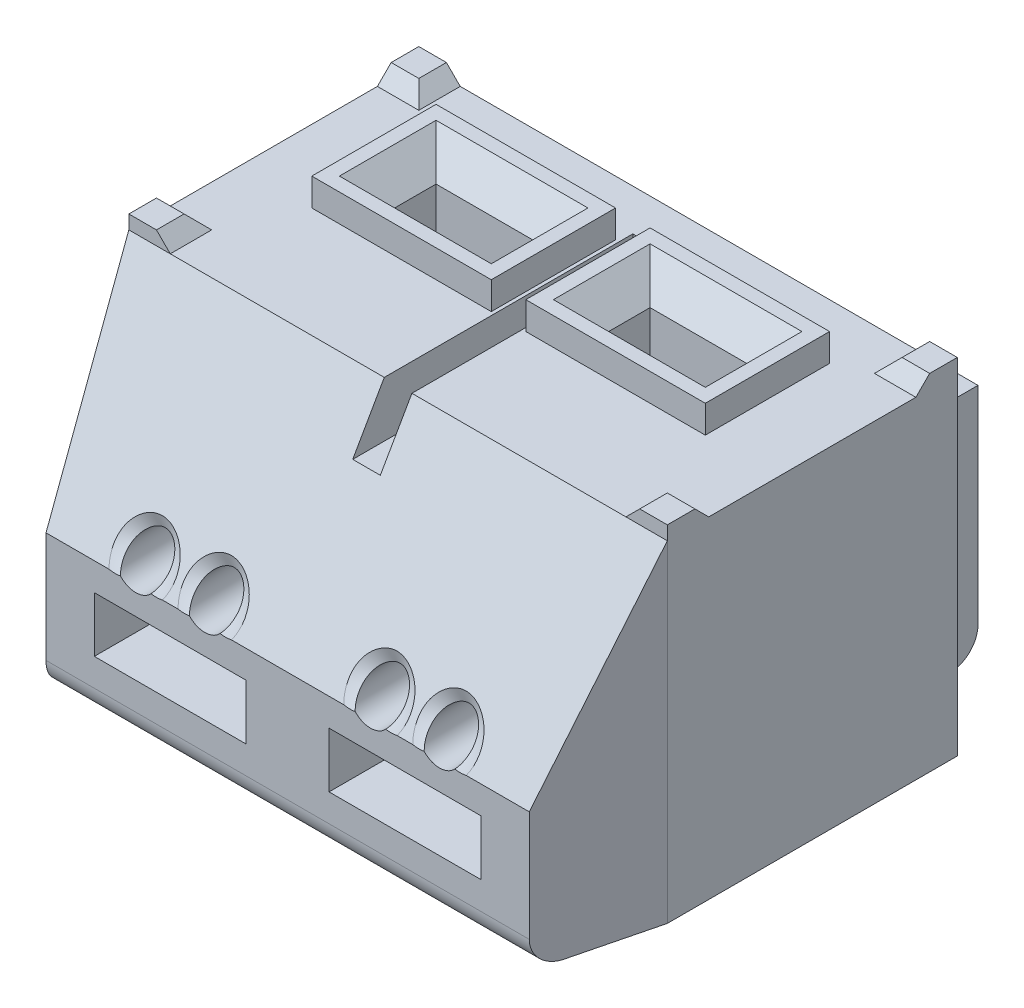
SolidWorks part; units mm, degrees
ref_plane "Plan de face" through (0, 0, 0) normal (0, 0, 1) x (1, 0, 0)
ref_plane "Plan de dessus" through (0, 0, 0) normal (0, 1, 0) x (1, 0, 0)
ref_plane "Plan de droite" through (0, 0, 0) normal (1, 0, 0) x (0, 0, -1)
sketch "Esquisse1" plane through (0, 0, 0) normal (0, 1, 0) x (1, 0, 0)
  line L1 (-9.75, 9) -> (9.75, 9)
  line L2 (-9.75, 9) -> (-9.75, -9)
  line L3 (-9.75, -9) -> (9.75, -9)
  line L4 (9.75, 9) -> (9.75, -9)
  dimension "D1" = 19.5
  dimension "D2" = 9.75
  dimension "D3" = 18
  dimension "D4" = 9
extrude "Extrusion1" add sketch "Esquisse1" along normal blind 12
sketch "Esquisse2" plane through (0, 12, 0) normal (0, 1, 0) x (-1, 0, 0)
  line L0 (0, 7.1336) -> (0, -6.4225) construction
  line L1 (-9.75, -9) -> (9.75, -9) construction
  line L2 (7.125, -3.5) -> (0.625, -3.5)
  line L3 (7.125, -3.5) -> (7.125, 1)
  line L4 (7.125, 1) -> (0.625, 1)
  line L5 (0.625, -3.5) -> (0.625, 1)
  line L6 (-7.125, 1) -> (-0.625, 1)
  line L7 (-0.625, -3.5) -> (-0.625, 1)
  line L8 (-7.125, -3.5) -> (-7.125, 1)
  line L9 (-7.125, -3.5) -> (-0.625, -3.5)
  dimension "D1" = 6.5
  dimension "D2" = 1.25
  dimension "D3" = 5.5
  dimension "D4" = 4.5
extrude "Extrusion2" add sketch "Esquisse2" along normal blind 1
sketch "Esquisse3" plane through (0, 0, -9) normal (0, 0, -1) x (-1, 0, 0)
  line L0 (-7, 8.5) -> (7, 8.5)
  line L1 (7, 8.5) -> (7, -0.9891)
  line L2 (10.3623, -0.9891) -> (10.3623, 14.3031)
  line L3 (10.3623, 14.3031) -> (-10.2681, 14.3031)
  line L4 (-10.2681, 14.3031) -> (-10.2681, -0.9891)
  line L5 (-9.75, 12) -> (9.75, 12) construction
  line L6 (-7, 8.5) -> (-7, -0.9891)
  line L7 (-7, -0.9891) -> (-10.2681, -0.9891)
  line L8 (7, -0.9891) -> (10.3623, -0.9891)
  dimension "D1" = 14
  dimension "D2" = 7
  dimension "D3" = 3.5
extrude "Enlèv. mat.-Extru.1" cut sketch "Esquisse3" against normal blind 3.5
sketch "Esquisse4" plane through (0, 13, 0) normal (0, 1, 0) x (-1, 0, 0)
  line L0 (0, 0) -> (0, -4.0855) construction
  line L1 (-7.125, 1) -> (-7.125, -3.5) construction
  line L2 (-5.625, -2) -> (-2.125, -2)
  line L3 (-5.625, -2) -> (-5.625, -0.5)
  line L4 (-5.625, -0.5) -> (-2.125, -0.5)
  line L5 (-2.125, -2) -> (-2.125, -0.5)
  line L7 (-0.625, 1) -> (-7.125, 1) construction
  line L8 (2.125, -2) -> (2.125, -0.5)
  line L9 (5.625, -0.5) -> (2.125, -0.5)
  line L10 (5.625, -2) -> (5.625, -0.5)
  line L11 (5.625, -2) -> (2.125, -2)
  dimension "D1" = 1.5
  dimension "D2" = 3.5
  dimension "D3" = 1.5
  dimension "D4" = 1.5
extrude "Enlèv. mat.-Extru.2" cut sketch "Esquisse4" against normal blind 5
chamfer "Chanfrein1" distance 1 angle 45 1 edges at (3.875, 13, -0.5)
chamfer "Chanfrein2" distance 1 angle 45 1 edges at (3.875, 13, -2)
chamfer "Chanfrein3" distance 1 angle 45 1 edges at (5.625, 13, -1.25)
chamfer "Chanfrein4" distance 1 angle 45 1 edges at (2.125, 13, -1.25)
chamfer "Chanfrein5" distance 1 angle 45 1 edges at (-3.875, 13, -0.5)
chamfer "Chanfrein6" distance 1 angle 45 1 edges at (-3.875, 13, -2)
chamfer "Chanfrein7" distance 1 angle 45 1 edges at (-2.125, 13, -1.25)
chamfer "Chanfrein8" distance 1 angle 45 1 edges at (-5.625, 13, -1.25)
sketch "Esquisse5" plane through (0, 8.5, 0) normal (0, 1, 0) x (-1, 0, 0)
  line L0 (7, -5.5) -> (7, -9) construction
  line L1 (-5.5, -5.5) -> (5.5, -5.5)
  line L2 (-5.5, -5.5) -> (-5.5, -7.5)
  line L3 (-5.5, -7.5) -> (5.5, -7.5)
  line L4 (5.5, -5.5) -> (5.5, -7.5)
  line L5 (-7, -5.5) -> (-7, -9) construction
  line L6 (-7, -9) -> (7, -9) construction
  dimension "D1" = 1.5
  dimension "D2" = 1.5
  dimension "D3" = 1.5
  dimension "D4" = 2
extrude "Enlèv. mat.-Extru.3" cut sketch "Esquisse5" against normal blind 3
sketch "Esquisse6" plane through (0, 0, -9) normal (0, 0, -1) x (-1, 0, 0)
  line L0 (-7, 0) -> (-7, 8.5) construction
  line L1 (-5.5, 6) -> (5.5, 6)
  line L2 (-5.5, 6) -> (-5.5, 3)
  line L3 (-5.5, 3) -> (5.5, 3)
  line L4 (5.5, 6) -> (5.5, 3)
  line L5 (7, 8.5) -> (7, 0) construction
  line L6 (-7, 8.5) -> (7, 8.5) construction
  dimension "D1" = 1.5
  dimension "D2" = 1.5
  dimension "D3" = 2.5
  dimension "D4" = 3
extrude "Enlèv. mat.-Extru.4" cut sketch "Esquisse6" against normal blind 3.5
sketch "Esquisse7" plane through (0, 12, 0) normal (0, 1, 0) x (-1, 0, 0)
  line L0 (0, 0) -> (0, -8.3305) construction
  line L1 (9.75, -5.5) -> (-9.75, -5.5) construction
  line L2 (-0.5, -4) -> (0.5, -4)
  line L3 (-0.5, -4) -> (-0.5, 10.8093)
  line L4 (-0.5, 10.8093) -> (0.5, 10.8093)
  line L5 (0.5, -4) -> (0.5, 10.8093)
  dimension "D1" = 1
  dimension "D2" = 0.5
  dimension "D3" = 1.5
extrude "Enlèv. mat.-Extru.5" cut sketch "Esquisse7" against normal blind 2
fillet "Congé2" radius 1 1 edges at (0, 0, -9)
sketch "Esquisse8" plane through (0, 0, 9) normal (0, 0, 1) x (1, 0, 0)
  line L0 (0, -0.5181) -> (0, 7.0495) construction
  line L1 (-9.75, 0) -> (9.75, 0) construction
  line L2 (-7, 4) -> (-1.5, 4)
  line L3 (-7, 4) -> (-7, 2)
  line L4 (-7, 2) -> (-1.5, 2)
  line L5 (-1.5, 4) -> (-1.5, 2)
  line L6 (1.5, 4) -> (1.5, 2)
  line L7 (7, 2) -> (1.5, 2)
  line L8 (7, 4) -> (1.5, 4)
  line L9 (7, 4) -> (7, 2)
  dimension "D1" = 5.5
  dimension "D2" = 1.5
  dimension "D3" = 2
  dimension "D4" = 2
extrude "Enlèv. mat.-Extru.6" cut sketch "Esquisse8" against normal blind 2
sketch "Esquisse9" plane through (0, 0, 9) normal (0, 0, 1) x (1, 0, 0)
  line L0 (0, 0) -> (0, 10.221) construction
  line L1 (-9.1063, 5.5) -> (6.5628, 5.5) construction
  line L2 (-9.75, 0) -> (9.75, 0) construction
  line L4 (-7, 4) -> (-7, 2) construction
  line L5 (-1.5, 2) -> (-1.5, 4) construction
  circle A0 centre (-5.5, 5.5) radius 0.75
  circle A1 centre (-3, 5.5) radius 0.75
  circle A2 centre (3, 5.5) radius 0.75
  circle A3 centre (5.5, 5.5) radius 0.75
  point P9 (-7, 3)
  dimension "D2" = 1.5
  dimension "D4" = 1.5
  dimension "D1" = 5.5
  dimension "D3" = 1.5
  dimension "D5" = 1.5
extrude "Enlèv. mat.-Extru.7" cut sketch "Esquisse9" against normal blind 5
sketch "Esquisse10" plane through (-9.75, 0, 0) normal (-1, 0, 0) x (0, 0, 1)
  line L0 (5, 12) -> (9, 5)
  line L1 (-5.5, 12) -> (9, 12) construction
  line L2 (9, 12) -> (9, 0) construction
  line L3 (9, 10) -> (9, 12) construction
  line L4 (-5.5, 0) -> (9, 0) construction
  line L5 (5, 12) -> (9, 12)
  line L6 (9, 12) -> (9, 5)
  point P6 (9, 11)
  dimension "D1" = 4
  dimension "D2" = 5
extrude "Enlèv. mat.-Extru.8" cut sketch "Esquisse10" against normal through all
sketch "Esquisse11" plane through (0, 0, 0) normal (0, -1, 0) x (1, 0, 0)
  line L0 (8.75, 9) -> (8.75, 9.7291)
  line L1 (-9.75, 9) -> (9.75, 9) construction
  line L3 (8.75, 9.7291) -> (11.6014, 9.7291)
  line L4 (8.75, 9) -> (9.75, 5)
  line L5 (0, 0) -> (0, 11.3376) construction
  line L6 (-8.75, 9) -> (-9.75, 5)
  line L7 (-9.75, 9) -> (-9.75, 5)
  line L8 (11.6014, 9.7291) -> (11.6014, 5)
  line L9 (9.75, 9) -> (9.75, -5.5) construction
  line L10 (9.75, 5) -> (11.6014, 5)
  line L11 (-8.75, 9) -> (-9.75, 9)
  dimension "D1" = 1
  dimension "D2" = 4
extrude "Enlèv. mat.-Extru.9" cut sketch "Esquisse11" against normal through all
fillet "Congé3" radius 1 1 edges at (0, 0, 9)
chamfer "Chanfrein9" distance 0.5 angle 44 1 edges at (-3, 6.25, 8.2857)
chamfer "Chanfrein10" distance 0.5 angle 44 1 edges at (-5.5, 6.25, 8.2857)
chamfer "Chanfrein11" distance 0.5 angle 44 1 edges at (3, 6.25, 8.2857)
chamfer "Chanfrein12" distance 0.5 angle 44 1 edges at (5.5, 6.25, 8.2857)
sketch "Esquisse12" plane through (0, 12, 0) normal (0, 1, 0) x (-1, 0, 0)
  line L0 (0, 0) -> (0, -10.7592) construction
  line L1 (-9.75, 5) -> (-9.75, -5.5) construction
  line L2 (-9.75, 3.5) -> (-8.25, 3.5)
  line L3 (-9.75, 3.5) -> (-9.75, 5)
  line L4 (-9.75, 5) -> (-8.25, 5)
  line L5 (-8.25, 3.5) -> (-8.25, 5)
  line L6 (-9.75, 5) -> (-0.5, 5) construction
  line L7 (9.75, -5.5) -> (-9.75, -5.5) construction
  line L8 (-9.75, -5.5) -> (-8.25, -5.5)
  line L9 (-9.75, -5.5) -> (-9.75, -4)
  line L10 (-9.75, -4) -> (-8.25, -4)
  line L11 (-8.25, -5.5) -> (-8.25, -4)
  line L12 (9.75, 5) -> (8.25, 5)
  line L13 (8.25, 3.5) -> (8.25, 5)
  line L14 (9.75, 3.5) -> (9.75, 5)
  line L15 (9.75, 3.5) -> (8.25, 3.5)
  line L16 (9.75, -4) -> (8.25, -4)
  line L17 (8.25, -5.5) -> (8.25, -4)
  line L18 (9.75, -5.5) -> (9.75, -4)
  line L19 (9.75, -5.5) -> (8.25, -5.5)
  dimension "D1" = 1.5
  dimension "D2" = 1.5
  dimension "D3" = 1.5
  dimension "D4" = 1.5
  dimension "D5" = 1.5
  dimension "D6" = 1.5
  dimension "D7" = 1.5
  dimension "D8" = 1.5
extrude "Extrusion3" add sketch "Esquisse12" along normal blind 0.5
chamfer "Chanfrein13" distance 0.5 angle 45 1 edges at (-8.25, 12.5, 4.25)
chamfer "Chanfrein14" distance 0.5 angle 45 1 edges at (-9.25, 12.5, 3.5)
chamfer "Chanfrein15" distance 0.5 angle 45 1 edges at (-8.25, 12.5, -4.75)
chamfer "Chanfrein16" distance 0.5 angle 45 1 edges at (-9.25, 12.5, -4)
chamfer "Chanfrein17" distance 0.5 angle 45 1 edges at (9, 12.5, -4)
chamfer "Chanfrein18" distance 0.5 angle 45 1 edges at (8.25, 12.5, -5)
chamfer "Chanfrein19" distance 0.5 angle 45 1 edges at (9, 12.5, 3.5)
chamfer "Chanfrein20" distance 0.5 angle 45 1 edges at (8.25, 12.5, 4.5)
